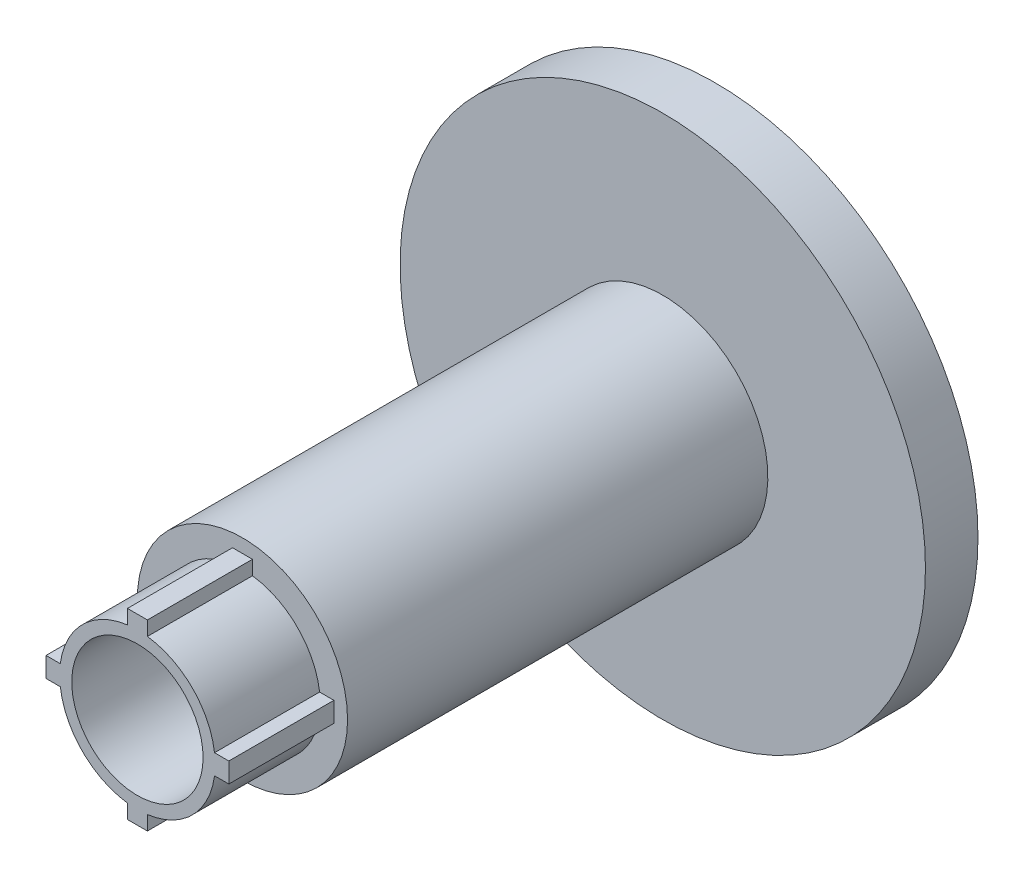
SolidWorks part; units mm, degrees
ref_plane "前视基准面" through (0, 0, 0) normal (0, 0, 1) x (1, 0, 0)
ref_plane "上视基准面" through (0, 0, 0) normal (0, 1, 0) x (1, 0, 0)
ref_plane "右视基准面" through (0, 0, 0) normal (1, 0, 0) x (0, 0, -1)
other "Configuration Table"
sketch "草图1" plane through (0, 0, 0) normal (0, 0, 1) x (1, 0, 0)
  circle A0 centre (0, 0) radius 50
  dimension "D1" = 100
extrude "凸台-拉伸1" add sketch "草图1" along normal blind 10
sketch "草图2" plane through (0, 0, 10) normal (0, 0, 1) x (1, 0, 0)
  circle A0 centre (0, 0) radius 20
  dimension "D1" = 40
extrude "凸台-拉伸2" add sketch "草图2" along normal blind 80
sketch "草图3" plane through (0, 0, 90) normal (0, 0, 1) x (1, 0, 0)
  circle A0 centre (0, 0) radius 12.5
  dimension "D1" = 25
extrude "切除-拉伸1" cut sketch "草图3" against normal blind 80
sketch "草图5" plane through (0, 0, 90) normal (0, 0, 1) x (1, 0, 0)
  line L1 (-1.9, -17.4) -> (1.9, -17.4)
  line L2 (-1.9, -17.4) -> (-1.9, -14.6775)
  line L3 (-1.9, 17.4) -> (1.9, 17.4)
  line L4 (1.9, -17.4) -> (1.9, -14.6775)
  line L5 (-1.9, -17.4) -> (-1.6065, -14.7125) construction
  line L6 (-1.9, 17.4) -> (-1.6065, 14.7125) construction
  line L7 (-17.4, 1.9) -> (-14.6775, 1.9)
  line L8 (-17.4, 1.9) -> (-17.4, -1.9)
  line L9 (-17.4, -1.9) -> (-14.6775, -1.9)
  line L10 (17.4, 1.9) -> (17.4, -1.9)
  line L11 (-17.4, 1.9) -> (-14.7125, 1.6065) construction
  line L12 (-17.4, -1.9) -> (-14.7125, -1.6065) construction
  line L18 (1.6065, -14.7125) -> (1.9, -17.4) construction
  line L20 (14.6775, -1.9) -> (17.4, -1.9)
  line L21 (14.7125, -1.6065) -> (17.4, -1.9) construction
  line L22 (14.7125, 1.6065) -> (17.4, 1.9) construction
  line L23 (14.6775, 1.9) -> (17.4, 1.9)
  line L24 (1.9, 14.6775) -> (1.9, 17.4)
  line L25 (1.6065, 14.7125) -> (1.9, 17.4) construction
  line L27 (-1.9, 14.6775) -> (-1.9, 17.4)
  circle A0 centre (0, 0) radius 12.5
  arc A1 (-14.6775, -1.9) -> (-1.9, -14.6775) centre (0, 0) ccw
  arc A2 (-1.9, 14.6775) -> (-14.6775, 1.9) centre (0, 0) ccw
  arc A3 (14.6775, 1.9) -> (1.9, 14.6775) centre (0, 0) ccw
  arc A4 (1.9, -14.6775) -> (14.6775, -1.9) centre (0, 0) ccw
  dimension "D1" = 29.6
  dimension "D2" = 3.8
  dimension "D3" = 34.8
  dimension "D4" = 3.8
  dimension "D5" = 34.8
extrude "凸台-拉伸3" add sketch "草图5" along normal blind 20
sketch "草图6" plane through (0, 0, 0) normal (0, 0, -1) x (-1, 0, 0)
  line L1 (-2, -17.5) -> (2, -17.5)
  line L2 (-2, -17.5) -> (-2, -9.798)
  line L3 (-2, 17.5) -> (2, 17.5)
  line L4 (2, -17.5) -> (2, -9.798)
  line L7 (-17.5, 2) -> (-9.798, 2)
  line L8 (-17.5, 2) -> (-17.5, -2)
  line L9 (-17.5, -2) -> (-9.798, -2)
  line L10 (17.5, 2) -> (17.5, -2)
  line L12 (-17.5, -2) -> (-9.9353, -1.1355) construction
  line L13 (-2, 9.798) -> (-2, 17.5)
  line L15 (2, 9.798) -> (2, 17.5)
  line L23 (9.798, -2) -> (17.5, -2)
  line L27 (9.798, 2) -> (17.5, 2)
  arc A0 (-2, 9.798) -> (-9.798, 2) centre (0, 0) ccw
  arc A1 (2, -9.798) -> (9.798, -2) centre (0, 0) ccw
  arc A2 (9.798, 2) -> (2, 9.798) centre (0, 0) ccw
  arc A3 (-9.798, -2) -> (-2, -9.798) centre (0, 0) ccw
  dimension "D1" = 20
  dimension "D2" = 35
  dimension "D3" = 35
  dimension "D4" = 4
  dimension "D5" = 4
extrude "切除-拉伸2" cut sketch "草图6" against normal blind 6
sketch "草图7" plane through (0, 0, 6) normal (0, 0, -1) x (-1, 0, 0)
  circle A0 centre (0, 0) radius 6.5
  dimension "D1" = 13
extrude "切除-拉伸3" cut sketch "草图7" against normal through all
sketch "草图9" plane through (0, 0, 0) normal (0, 1, 0) x (1, 0, 0)
  line L0 (-20, -10) -> (20, -10) construction
  circle A0 centre (0, -16.5) radius 6.5
  dimension "D2" = 13
  dimension "D1" = 6.5
extrude "切除-拉伸4" cut sketch "草图9" against normal through all
